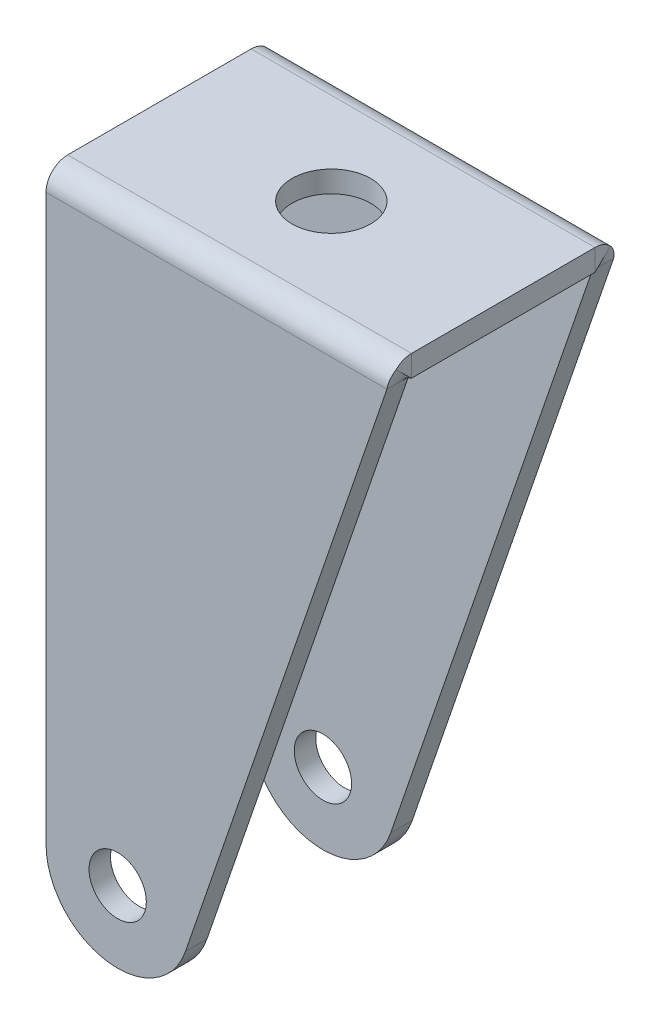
SolidWorks part; units mm, degrees
ref_plane "Front" through (0, 0, 0) normal (0, 0, 1) x (1, 0, 0)
ref_plane "Top" through (0, 0, 0) normal (0, 1, 0) x (1, 0, 0)
ref_plane "Right" through (0, 0, 0) normal (1, 0, 0) x (0, 0, -1)
sketch "Sketch1" plane through (0, 0, 0) normal (0, 1, 0) x (1, 0, 0)
  line L0 (0, 48.0003) -> (0, -46)
  line L8 (23.999, 8) -> (23.999, -6)
  line L9 (23.999, 8) -> (9.7298, 49.6218)
  line L10 (23.999, -6) -> (9.7298, -47.6215)
  circle A0 centre (5, 48.0003) radius 2
  arc A1 (9.7298, 49.6218) -> (0, 48.0003) centre (5, 48.0003) ccw
  circle A2 centre (5, -46) radius 2
  arc A3 (0, -46) -> (9.7298, -47.6215) centre (5, -46) ccw
  circle A4 centre (12, 1) radius 2.75
  dimension "D1" = 14
  dimension "D2" = 94.0003
  dimension "D3" = 47
sheet metal parameters "Sheet-Metal1" thickness 1.5 parameters "D1"=0.01
base flange "Base-Flange1" sketch "Sketch1" thickness 1.5 reverse thickness direction yes parameters "D1"=0.01
sketch "Sketch3" plane through (0, 1.5, 0) normal (0, 1, 0) x (-1, 0, 0)
  line L0 (-23.999, -8) -> (0, -8)
  line L1 (0, -48.0003) -> (0, 46) construction
  line L2 (-23.999, 6) -> (0, 6)
sketched bend "Sketched Bend1" parameters "D1"=0
bend "SketchBend1" bend radius 0.01 bend angle 90 parameters "D5"=1
bend "SketchBend2" bend radius 0 bend angle 90 parameters "D5"=2
flat pattern "Flat-Pattern1"
sketch "Bend-Lines1" plane through (0, 1.5, 0) normal (0, 1, 0) x (-1, 0, 0)
  line L0 (0, 6) -> (-23.999, 6) construction
  line L1 (0, -5.9997) -> (-23.999, -5.9997) construction
bend of the flat pattern "Flatten-<SketchBend1>1"
bend of the flat pattern "Flatten-<SketchBend2>1"
